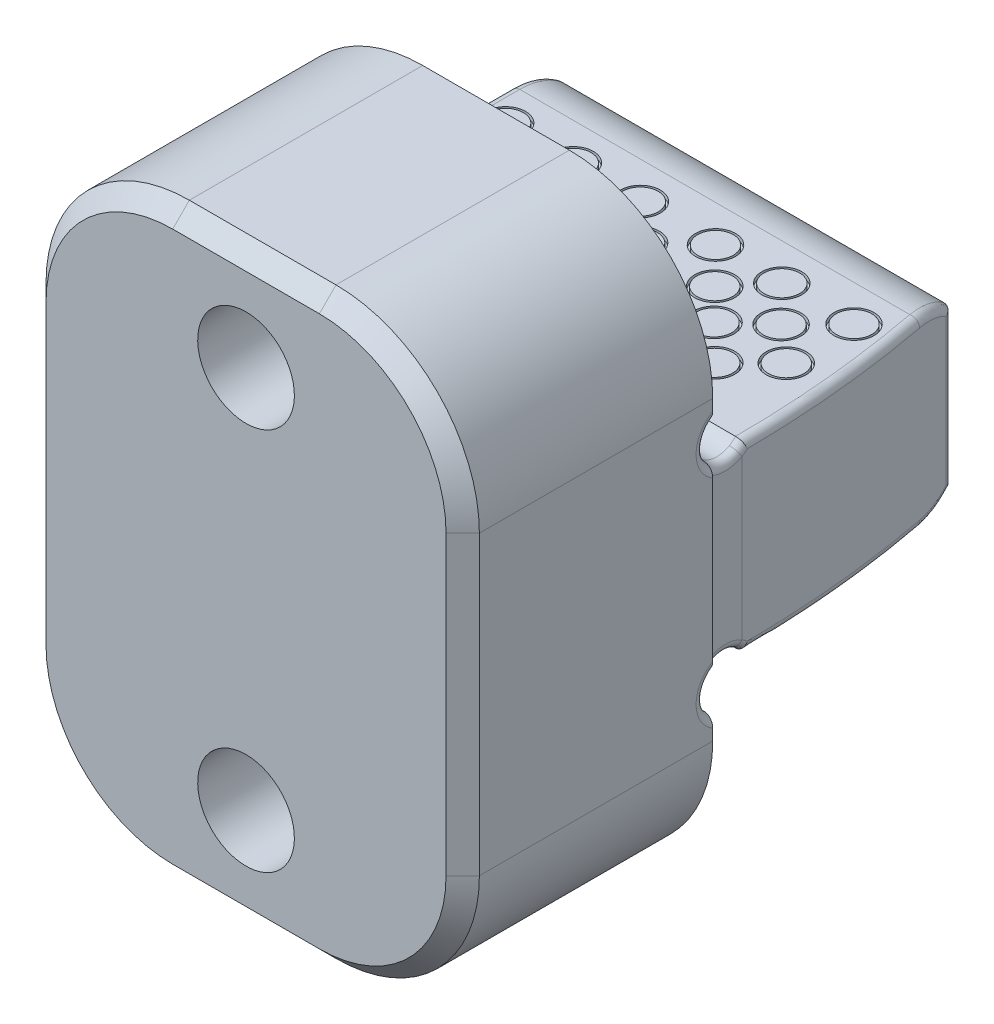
SolidWorks part; units mm, degrees
ref_plane "Front Plane" through (0, 0, 0) normal (0, 0, 1) x (1, 0, 0)
ref_plane "Top Plane" through (0, 0, 0) normal (0, 1, 0) x (1, 0, 0)
ref_plane "Right Plane" through (0, 0, 0) normal (1, 0, 0) x (0, 0, -1)
sketch "Sketch3" plane through (0, 0, 0) normal (1, 0, 0) x (0, 0, -1)
  line L0 (0, 8.7312) -> (0, -8.7312) construction
  line L1 (-15, -17.5) -> (0, -17.5)
  line L2 (-15, -17.5) -> (-15, 17.5)
  line L3 (-15, 17.5) -> (0, 17.5)
  line L4 (16.17, -5.4975) -> (16.17, 5.4975)
  line L6 (0, -17.5) -> (0, -5.4975)
  line L7 (0, -5.4975) -> (16.17, -5.4975)
  line L8 (0, 17.5) -> (0, 5.4975)
  line L9 (0, 5.4975) -> (16.17, 5.4975)
  line L10 (0, 0) -> (50000, 0) construction
  dimension "D1" = 31.17
  dimension "D2" = 15
  dimension "D3" = 35
  dimension "D4" = 10.995
extrude "Extrude1" add sketch "Sketch3" along normal mid plane 26
sketch "Sketch7" plane through (13, 0, 0) normal (1, 0, 0) x (0, 0, -1)
  line L0 (0, 17.5) -> (-15, 17.5) construction
  line L1 (0, -17.5) -> (21.9683, -17.5)
  line L2 (0, -17.5) -> (0, 17.5)
  line L3 (0, 17.5) -> (21.9683, 17.5)
  line L4 (21.9683, -17.5) -> (21.9683, 17.5)
  line L5 (0, -17.5) -> (0, -5.4975) construction
  line L6 (-15, -17.5) -> (0, -17.5) construction
extrude "Cut-Extrude3" cut sketch "Sketch7" against normal blind 0.25
sketch "Sketch8" plane through (13, 0, 0) normal (1, 0, 0) x (0, 0, -1)
  line L0 (0, 0) -> (50000, 0) construction
  line L1 (0, -17.5) -> (0, 17.5) construction
  line L2 (0, 5.4975) -> (16.17, 5.4975) construction
  circle A0 centre (1, 6.4975) radius 1.5
  circle A1 centre (1, -6.4975) radius 1.5
  dimension "D1" = 1.5
  dimension "D2" = 0.5
  dimension "D3" = 0.5
extrude "Cut-Extrude4" cut sketch "Sketch8" against normal through all
sketch "Sketch9" plane through (13, 0, 0) normal (1, 0, 0) x (0, 0, -1)
  line L0 (2.118, 5.4975) -> (16.17, 5.4975) construction
  line L1 (16.17, 5.4975) -> (16.17, -5.4975) construction
  line L2 (0, 0) -> (50000, 0) construction
  line L3 (16.17, 4.6385) -> (20.17, 4.6385)
  line L4 (13.67, 5.4975) -> (13.67, 11.1385)
  line L5 (13.67, 11.1385) -> (20.17, 11.1385)
  line L6 (20.17, 4.6385) -> (20.17, 11.1385)
  line L7 (20.17, -4.6385) -> (20.17, -11.1385)
  line L8 (13.67, -11.1385) -> (20.17, -11.1385)
  line L9 (13.67, -5.4975) -> (13.67, -11.1385)
  line L10 (16.17, -4.6385) -> (20.17, -4.6385)
  arc A0 (13.67, 5.4975) -> (15.8439, 5.1072) centre (13.67, -0.7525) cw construction
  arc A1 (15.8439, 5.1072) -> (16.17, 4.6385) centre (15.67, 4.6385) cw construction
  arc A2 (15.8439, -5.1072) -> (16.17, -4.6385) centre (15.67, -4.6385) ccw construction
  arc A3 (13.67, -5.4975) -> (15.8439, -5.1072) centre (13.67, 0.7525) ccw construction
  arc A4 (13.67, 5.4975) -> (16.17, 4.6385) centre (13.67, 1.4302) cw
  arc A5 (13.67, -5.4975) -> (16.17, -4.6385) centre (13.67, -1.4302) ccw
  dimension "D1" = 0.5
  dimension "D2" = 6.25
  dimension "D3" = 2.5
  dimension "D4" = 6.5
  dimension "D5" = 6.5
extrude "Cut-Extrude5" cut sketch "Sketch9" against normal through all
sketch "Sketch13" plane through (0, 17.5, 0) normal (0, 1, 0) x (1, 0, 0)
  line L0 (12.75, 2.118) -> (12.75, 13.67) construction
  line L2 (7.5773, 27) -> (27.5773, 27)
  line L4 (12.75, 2) -> (27.5773, 2)
  line L5 (27.5773, 27) -> (27.5773, 2)
  arc A0 (7.5773, 27) -> (12.75, 2) centre (-50.25, 2) cw
  dimension "D1" = 63
  dimension "D2" = 2
  dimension "D3" = 25
  dimension "D4" = 20
extrude "Cut-Extrude6" cut sketch "Sketch13" against normal through all
sketch "Sketch15" plane through (0, 5.4975, 0) normal (0, 1, 0) x (1, 0, 0)
  circle A0 centre (9.9718, 11.5035) radius 1.2
  circle A1 centre (9.9718, 11.5035) radius 1.07
  circle A2 centre (-6.8259, 11.4592) radius 1.2
  circle A3 centre (-6.8259, 11.4592) radius 1.07
  circle A4 centre (-10.9299, 11.5035) radius 1.2
  circle A5 centre (-10.9299, 11.5035) radius 1.07
  circle A6 centre (5.6839, 11.4592) radius 1.2
  circle A7 centre (5.6839, 11.4592) radius 1.07
  circle A8 centre (1.7056, 11.4592) radius 1.2
  circle A9 centre (1.7056, 11.4592) radius 1.07
  circle A10 centre (-2.8033, 11.4592) radius 1.2
  circle A11 centre (-2.8033, 11.4592) radius 1.07
  circle A14 centre (-4.7041, 9.2932) radius 1.2
  circle A15 centre (-4.7041, 9.2932) radius 1.07
  circle A16 centre (-8.7639, 9.2932) radius 1.2
  circle A17 centre (-8.7639, 9.2932) radius 1.07
  circle A18 centre (7.8057, 9.2932) radius 1.2
  circle A19 centre (7.8057, 9.2932) radius 1.07
  circle A20 centre (3.8274, 9.2932) radius 1.2
  circle A21 centre (3.8274, 9.2932) radius 1.07
  circle A22 centre (-0.6815, 9.2932) radius 1.2
  circle A23 centre (-0.6815, 9.2932) radius 1.07
  circle A24 centre (9.9718, 7.4367) radius 1.2
  circle A25 centre (9.9718, 7.4367) radius 1.07
  circle A26 centre (-6.8259, 7.3925) radius 1.2
  circle A27 centre (-6.8259, 7.3925) radius 1.07
  circle A28 centre (-10.9299, 7.4367) radius 1.2
  circle A29 centre (-10.9299, 7.4367) radius 1.07
  circle A30 centre (5.6839, 7.3925) radius 1.2
  circle A31 centre (5.6839, 7.3925) radius 1.07
  circle A32 centre (1.7056, 7.3925) radius 1.2
  circle A33 centre (1.7056, 7.3925) radius 1.07
  circle A34 centre (-2.8033, 7.3925) radius 1.2
  circle A35 centre (-2.8033, 7.3925) radius 1.07
  circle A38 centre (-4.7041, 5.3149) radius 1.2
  circle A39 centre (-4.7041, 5.3149) radius 1.07
  circle A40 centre (-8.7639, 5.3149) radius 1.2
  circle A41 centre (-8.7639, 5.3149) radius 1.07
  circle A42 centre (7.8057, 5.3149) radius 1.2
  circle A43 centre (7.8057, 5.3149) radius 1.07
  circle A44 centre (3.8274, 5.3149) radius 1.2
  circle A45 centre (3.8274, 5.3149) radius 1.07
  circle A46 centre (-0.6815, 5.3149) radius 1.2
  circle A47 centre (-0.6815, 5.3149) radius 1.07
  dimension "D7" = 2.4
  dimension "D8" = 2.14
extrude "Cut-Extrude7" cut sketch "Sketch15" against normal blind 0.254
mirror "Mirror1" about plane through (0, 0, 0) normal (0, 1, 0) of "Cut-Extrude7"
hole_wizard "CBORE for M5 SHCS1" positions "Sketch17" profile "Sketch16" counterbore size "M5" standard "Ansi Metric"
sketch "Sketch17" plane through (0, 0, 0) normal (0, 0, -1) x (-1, 0, 0)
  line L0 (0, 0) -> (50000, 0) construction
  point P0 (0, 11.5)
  point P9 (0, -11.5)
  dimension "D1" = 23
sketch "Sketch16" plane through (0, 11.5, 0) normal (1, 0, 0) x (0, 1, 0)
  line L0 (0, 0) -> (0, 15)
  line L1 (0, 15) -> (2.9, 15)
  line L3 (2.9, 15) -> (2.9, 6.5)
  line L4 (2.9, 6.5) -> (5, 6.5)
  line L5 (5, 6.5) -> (5, 0)
  line L7 (5, 0) -> (0, 0)
  line L11 (0, -6.35) -> (0, 107.95) construction
  dimension "Thru Hole Dia." = 5.8
  dimension "Thru Hole Depth" = 15
  dimension "C'Bore Dia." = 10
  dimension "C'Bore Depth" = 6.5
fillet "Fillet1" radius 8.6 4 edges at (-13, 17.5, 7.5) (-13, -17.5, 7.5) (13, -17.5, 7.5) (13, 17.5, 7.5)
chamfer "Chamfer1" distance 1 angle 45 8 edges at (0, 17.5, 15) (-10.4811, 14.9811, 15) (-13, 0, 15) (0, -17.5, 15) (-10.4811, -14.9811, 15) (13, 0, 15) (10.4811, 14.9811, 15) (10.4811, -14.9811, 15)
chamfer "Chamfer2" distance 0.4 angle 45 4 edges at (0.0263, 6.5001, 0.5) (-0.0263, -6.5001, 0.5) (0, -16.5, 0) (0, 16.5, 0)
mirror "Mirror2" about plane through (0, 0, 0) normal (1, 0, 0) of "Cut-Extrude3"
fillet "Fillet2" radius 0.5 24 edges at (12.4713, 5.4975, -7.9192) (11.406, -5.293, -14.9436) (11.3856, 5.2597, -15.0403) (11.1358, 0, -16.17) (12.4713, -5.4975, -7.9192) (12.75, -4.9975, -1) (13, -6.4975, 0.5) (12.875, -5.3795, 0) (13, 6.4975, 0.5) (12.875, 5.3795, 0) (12.75, 4.9975, -1) (-12.75, 5.2768, -14.9917) (-12.75, -4.9998, -1.0835) (-12.75, 4.9998, -1.0835) (-12.75, -5.4975, -7.894) (-12.75, -5.2768, -14.9917) (-12.75, 0, -16.17) (-12.75, 5.4975, -7.894) (-12.875, 5.3795, 0) (-12.875, -5.3795, 0) (-13, -6.4975, 0.5) (-13, 6.4975, 0.5)
